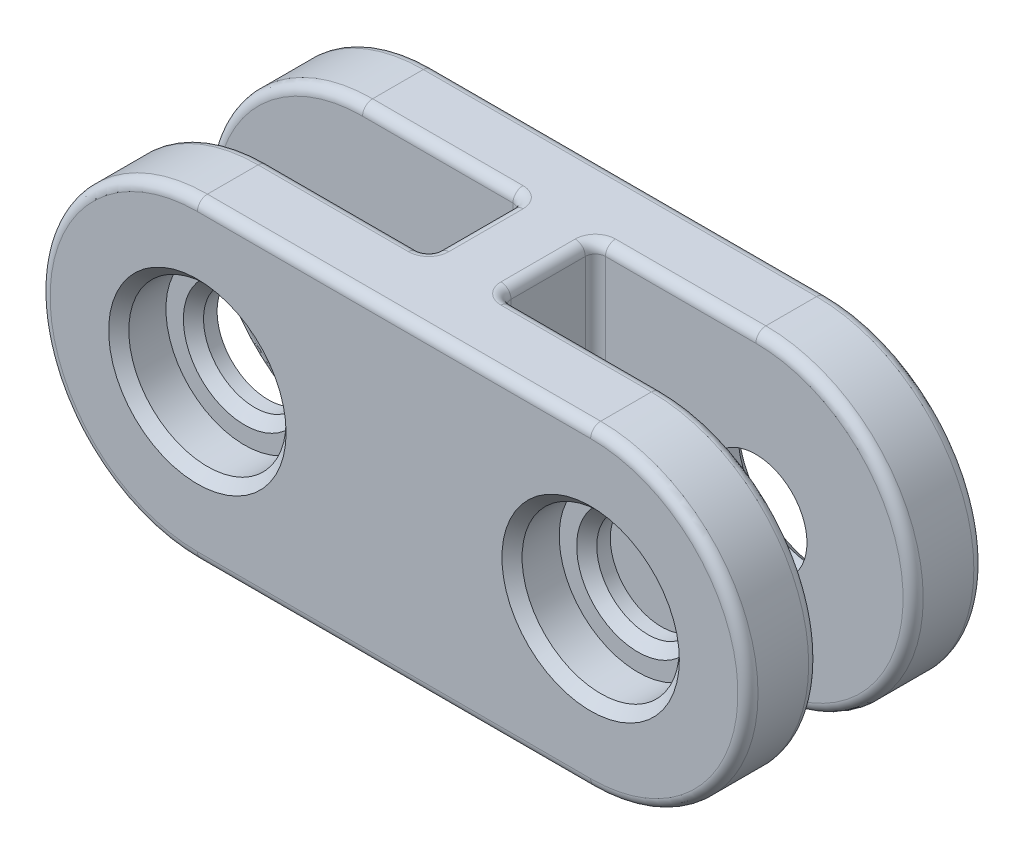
SolidWorks part; units mm, degrees
ref_plane "Front Plane" through (0, 0, 0) normal (0, 0, 1) x (1, 0, 0)
ref_plane "Top Plane" through (0, 0, 0) normal (0, 1, 0) x (1, 0, 0)
ref_plane "Right Plane" through (0, 0, 0) normal (1, 0, 0) x (0, 0, -1)
sketch "Sketch1" plane through (0, 0, 0) normal (0, 0, 1) x (1, 0, 0)
  line L0 (0, 0) -> (31.75, 0) construction
  line L1 (0, 12.7) -> (31.75, 12.7)
  line L2 (0, -12.7) -> (31.75, -12.7)
  arc A0 (0, 12.7) -> (0, -12.7) centre (0, 0) ccw
  arc A1 (31.75, -12.7) -> (31.75, 12.7) centre (31.75, 0) ccw
  circle A2 centre (0, 0) radius 4.1275
  circle A3 centre (31.75, 0) radius 4.1275
  point P3 (15.875, 0)
  dimension "D2" = 12.7
  dimension "D3" = 8.255
  dimension "D1" = 31.75
extrude "Boss-Extrude1" add sketch "Sketch1" along normal mid plane 19.05
sketch "Sketch2" plane through (0, 0, 9.525) normal (0, 0, 1) x (1, 0, 0)
  circle A0 centre (31.75, 0) radius 6.35
  circle A1 centre (0, 0) radius 6.35
  dimension "D1" = 12.7
extrude "Cut-Extrude1" cut sketch "Sketch2" against normal blind 3.81
mirror "Mirror1" about plane through (0, 0, 0) normal (0, 0, 1) of "Cut-Extrude1"
sketch "Sketch3" plane through (0, 12.7, 0) normal (0, 1, 0) x (1, 0, 0)
  line L0 (-12.7, 3.81) -> (-12.7, -3.81)
  line L1 (44.45, -9.525) -> (44.45, 9.525) construction
  line L2 (44.394, 0) -> (-12.7, 0) construction
  line L3 (-12.7, 9.525) -> (-12.7, -9.525) construction
  line L4 (15.875, 9.525) -> (15.875, -9.525) construction
  line L5 (31.75, 9.525) -> (0, 9.525) construction
  line L6 (31.75, -9.525) -> (0, -9.525) construction
  line L7 (44.45, 3.81) -> (18.796, 3.81)
  line L8 (44.45, 3.81) -> (44.45, -3.81)
  line L9 (44.45, -3.81) -> (18.796, -3.81)
  line L10 (18.796, 3.81) -> (18.796, -3.81)
  line L11 (-12.7, 3.81) -> (12.954, 3.81)
  line L12 (12.954, 3.81) -> (12.954, -3.81)
  line L13 (-12.7, -3.81) -> (12.954, -3.81)
  dimension "D1" = 5.842
  dimension "D2" = 7.62
extrude "Cut-Extrude3" cut sketch "Sketch3" against normal through all
fillet "Fillet1" radius 0.8128 28 edges at (6.477, -12.7, -3.81) (15.875, -12.7, -9.525) (25.273, -12.7, 3.81) (25.273, -12.7, -3.81) (44.45, 0, -3.81) (44.45, 0, -9.525) (6.477, 12.7, 3.81) (-12.7, 0, 3.81) (-12.7, 0, -3.81) (-12.7, 0, -9.525) (12.954, 0, -3.81) (18.796, 0, 3.81) (18.796, -12.7, 0) (12.954, -12.7, 0) (12.954, 0, 3.81) (6.477, -12.7, 3.81) (6.477, 12.7, -3.81) (12.954, 12.7, 0) (18.796, 12.7, 0) (18.796, 0, -3.81) (25.273, 12.7, -3.81) (25.273, 12.7, 3.81) (44.45, 0, 3.81) (44.45, 0, 9.525) (15.875, -12.7, 9.525) (-12.7, 0, 9.525) (15.875, 12.7, 9.525) (15.875, 12.7, -9.525)
chamfer "Chamfer1" distance 0.8128 angle 45 8 edges at (6.35, 0, 9.525) (4.1275, 0, 5.715) (38.1, 0, 9.525) (35.8775, 0, 5.715) (27.6225, 0, -5.715) (38.1, 0, -9.525) (6.35, 0, -9.525) (-4.1275, 0, -5.715)
